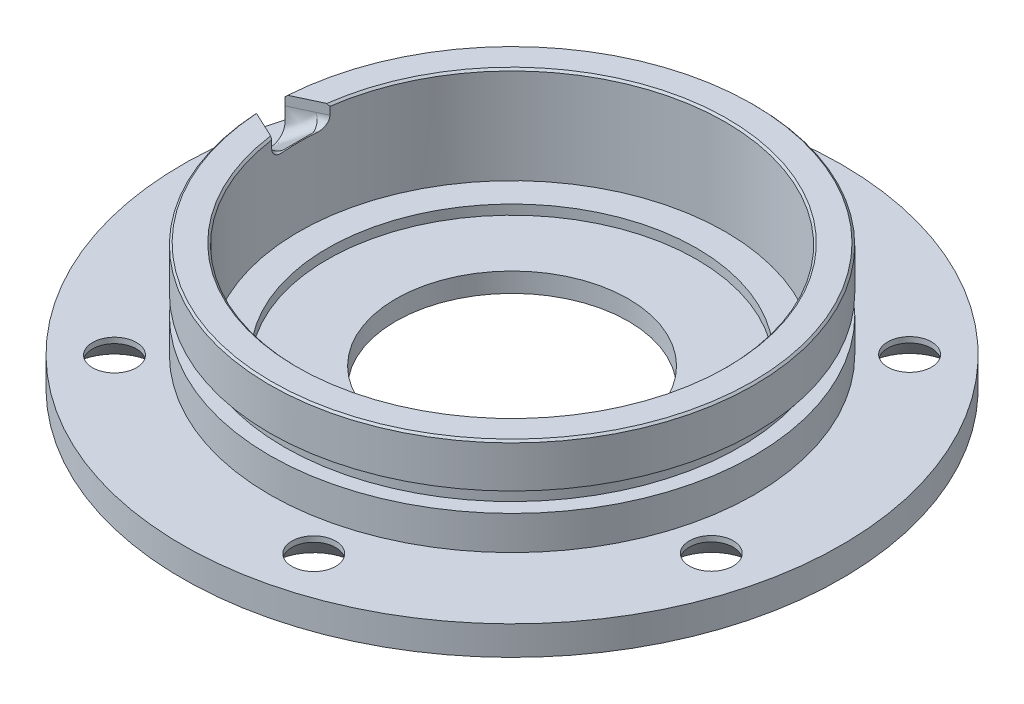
SolidWorks part; units mm, degrees
ref_plane "Front Plane" through (0, 0, 0) normal (0, 0, 1) x (1, 0, 0)
ref_plane "Top Plane" through (0, 0, 0) normal (0, 1, 0) x (1, 0, 0)
ref_plane "Right Plane" through (0, 0, 0) normal (1, 0, 0) x (0, 0, -1)
sketch "Sketch1" plane through (0, 0, 0) normal (0, 0, 1) x (1, 0, 0)
  line L0 (0, 0) -> (0, 44.6601) construction
  line L1 (-9.525, -5) -> (-9.525, -5.5)
  line L2 (-11, -5) -> (-11, 0)
  line L3 (-9.525, -5.5) -> (-6, -5.5)
  line L4 (-6, -5.5) -> (-6, -6.5)
  line L6 (-12.5, 0) -> (-12.5, -2.25)
  line L8 (-17, -5) -> (-17, -6.5)
  line L9 (-17, -6.5) -> (-6, -6.5)
  line L11 (-12.5, 0) -> (-11, 0)
  line L13 (0, 0) -> (-68.5328, 0) construction
  line L15 (-12.5, -2.25) -> (-11.75, -2.25)
  line L16 (-11, -5) -> (-9.525, -5)
  line L17 (-11.75, -2.25) -> (-11.75, -3.25)
  line L18 (-11.75, -3.25) -> (-12.5, -3.25)
  line L19 (-12.5, -3.25) -> (-12.5, -5)
  line L20 (-12.5, -5) -> (-17, -5)
  dimension "D1" = 12
  dimension "D2" = 25
  dimension "D3" = 0.75
  dimension "D4" = 22
  dimension "D5" = 5
  dimension "D6" = 2.25
  dimension "D7" = 19.05
  dimension "D8" = 0.5
  dimension "D9" = 6.5
  dimension "D10" = 34
  dimension "D11" = 1
  dimension "D13" = 5
revolve "Revolve1" add sketch "Sketch1" angle 360 about L0
sketch "Sketch8" plane through (0, 0, 0) normal (0, 1, 0) x (1, 0, 0)
  line L0 (-12.5, -0.75) -> (-12.5, 0.75)
  line L1 (-12.5, 0.75) -> (-10.8972, 1.5)
  line L2 (-10.8972, 1.5) -> (-10.8972, -1.5)
  line L3 (0, 0) -> (-68.5328, 0) construction
  line L4 (-12.5, 0) -> (0, 0) construction
  line L5 (-12.5, -0.75) -> (-10.8972, -1.5)
  circle A0 centre (0, 0) radius 11 construction
  point P12 (-10.8972, 0)
  dimension "D1" = 3
  dimension "D2" = 1.5
extrude "Cut-Extrude1" cut sketch "Sketch8" against normal blind 1
ref_plane "Plane1" through (-12.5, 0, 0) normal (-1, 0, 0) x (0, 0, 1)
ref_plane "Plane2" through (-11.05, 0, 0) normal (-1, 0, 0) x (0, 0, 1)
sketch "Sketch6" plane through (-12.5, 0, 0) normal (-1, 0, 0) x (0, 0, 1)
  line L0 (0, -0.5) -> (0, 0) construction
  line L1 (-0.75, -1.26) -> (-0.75, 0)
  line L2 (-0.75, 0) -> (0.75, 0)
  line L3 (0.75, 0) -> (0.75, -1.26)
  line L4 (0, -2) -> (0, -0.5) construction
  line L5 (-0.01, -2) -> (0.01, -2)
  arc A0 (0.75, -1.26) -> (0.01, -2) centre (0.01, -1.26) cw
  arc A1 (-0.01, -2) -> (-0.75, -1.26) centre (-0.01, -1.26) cw
  dimension "D1" = 1.5
  dimension "D3" = 0.74
  dimension "D2" = 0.5
  dimension "D4" = 2
sketch "Sketch7" plane through (-11.05, 0, 0) normal (-1, 0, 0) x (0, 0, 1)
  line L0 (1.4285, 0) -> (-1.4285, 0) construction
  line L1 (-1.4285, 0) -> (-1.4285, -0.26)
  line L2 (-0.6885, -1) -> (0.6885, -1)
  line L3 (1.4285, -0.26) -> (1.4285, 0)
  line L4 (0, -1) -> (0, 0) construction
  line L5 (1.4285, 0) -> (1.4285, 1)
  line L6 (1.4285, 1) -> (-1.4285, 1)
  line L7 (-1.4285, 1) -> (-1.4285, 0)
  arc A0 (-1.4285, -0.26) -> (-0.6885, -1) centre (-0.6885, -0.26) ccw
  arc A1 (0.6885, -1) -> (1.4285, -0.26) centre (0.6885, -0.26) ccw
  dimension "D1" = 0.74
  dimension "D3" = 1
  dimension "D4" = 2
fillet "Fillet1" radius 0.5 2 edges at (-11.687, -1, -1.1304) (-11.687, -1, 1.1304)
loft "Cut-Loft1" cut profiles "Sketch6", "Sketch7"
chamfer "Chamfer1" distance 0.1 angle 45 2 edges at (12.5, 0, 0) (11, 0, 0)
hole_wizard "CSK for #2 Flat Head Machine Screw1" positions "Sketch10" profile "Sketch9" countersink size "#2" standard "ANSI Inch"
sketch "Sketch10" plane through (0, -6.5, 0) normal (0, -1, 0) x (-1, 0, 0)
  circle A0 centre (10.2395, -10.2666) radius 0.889 construction
  point P0 (10.2395, -10.2666)
sketch "Sketch9" plane through (-10.2395, -6.5, 10.2666) normal (1, 0, 0) x (0, 0, -1)
  line L0 (0, 0) -> (0, 6.5)
  line L1 (0, 6.5) -> (1.1303, 6.5)
  line L2 (1.1303, 6.5) -> (1.1303, 1.2126)
  line L3 (1.1303, 1.2126) -> (2.1844, 0)
  line L5 (2.1844, 0) -> (0, 0)
  line L6 (-1.1303, 1.2126) -> (-2.1844, 0) construction
  line L11 (0, -6.35) -> (0, 107.95) construction
  dimension "Thru Hole Dia." = 2.2606
  dimension "Thru Hole Depth" = 6.5
  dimension "Near C'Sink Dia." = 4.3688
  dimension "Near C'Sink Angle" = 82
pattern_circular "CirPattern1" count 6 over 360 about axis through (0, 0, 0) along (0, 1, 0) of "CSK for #2 Flat Head Machine Screw1"
